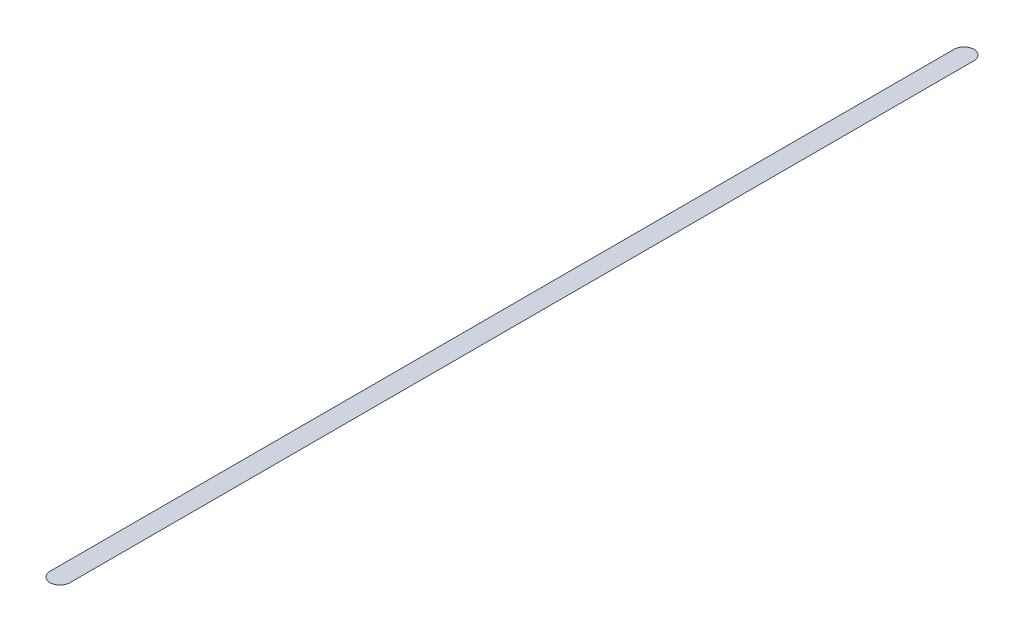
SolidWorks part; units mm, degrees
ref_plane "Plane1" through (0, 0, 0) normal (0, 0, 1) x (1, 0, 0)
ref_plane "Plane2" through (0, 0, 0) normal (0, 1, 0) x (1, 0, 0)
ref_plane "Plane3" through (0, 0, 0) normal (1, 0, 0) x (0, 0, -1)
sketch "Sketch1" plane through (0, 0, 0) normal (0, 0, 1) x (1, 0, 0)
  line L0 (-25, 5) -> (25, 5)
  line L1 (-25, 5) -> (-25, 0)
  line L2 (25, 0) -> (-25, 0)
  line L3 (25, 0) -> (25, 5)
  line L4 (0, 5) -> (0, 0) construction
  line L5 (50, 0) -> (-50, 0) construction
  dimension "D1" = 50
  dimension "D2" = 5
extrude "Base-Extrude" add sketch "Sketch1" along normal mid plane 203.2
sketch "Sketch10" plane through (0, 0, 0) normal (0, 1, 0) x (-1, 0, 0)
  line L4 (0.635, 88.265) -> (0.635, -88.265) construction
  line L5 (0, 50) -> (0, -50) construction
  line L6 (-0.635, 88.265) -> (-0.635, -88.265) construction
  line L8 (-0.635, 0) -> (0.635, 0) construction
  arc A0 (0.635, -88.265) -> (-0.635, -88.265) centre (0, -88.265) cw construction
  arc A1 (-0.635, 88.265) -> (0.635, 88.265) centre (0, 88.265) cw construction
  dimension "D1" = 1.27
  dimension "Rib Length" = 177.8
ref_plane "Plane4" through (0, 0, -88.265) normal (0, 0, 1) x (1, 0, 0)
ref_plane "Plane5" through (0, 0, 88.265) normal (0, 0, 1) x (1, 0, 0)
sketch "Sketch2" plane through (0, 0, -88.265) normal (0, 0, 1) x (1, 0, 0)
  line L0 (25, 0) -> (-25, 0) construction
  line L1 (0, -50) -> (0, 50) construction
  line L2 (0.635, 0) -> (-0.635, 0) construction
  line L3 (0.635, 0) -> (0.635, -0.582) construction
  line L4 (0.635, -0.582) -> (-0.635, -0.582) construction
  line L5 (-0.635, -0.582) -> (-0.635, 0) construction
  line L6 (-0.254, 0) -> (0.254, 0)
  arc A0 (-0.254, 0) -> (0.254, 0) centre (0, -0.582) ccw
  point P10 (0, 0)
  dimension "D1" = 1.217
  dimension "D2" = 0.508
extrude "Boss-Extrude1" add sketch "Sketch2" along normal up to surface (176.53 mm away)
sketch "Sketch7" plane through (0, 0, 88.265) normal (0, 0, 1) x (1, 0, 0)
  line L1 (0, 0) -> (0, -1.217)
  line L2 (0.254, 0) -> (-0.254, 0)
  line L3 (0, 0) -> (-0.254, 0)
  arc A1 (-0.254, 0) -> (0.254, 0) centre (0, -0.582) ccw
  arc A2 (-0.254, 0) -> (0, -1.217) centre (0, -0.582) ccw
  dimension "D1" = 0
revolve "Boss-Revolve3" add sketch "Sketch7" angle 180 about L1
sketch "Sketch9" plane through (0, 0, -88.265) normal (0, 0, 1) x (1, 0, 0)
  line L1 (0, 0) -> (0, -1.217)
  line L2 (0, 0) -> (0, -1.217) construction
  line L3 (0, 0) -> (-0.254, 0)
  line L4 (0, 0) -> (-0.254, 0) construction
  arc A2 (-0.254, 0) -> (0, -1.217) centre (0, -0.582) ccw
revolve "Boss-Revolve4" add sketch "Sketch9" angle 180 about L1
fillet "Fillet3" radius 1.524 4 edges at (0.254, 0, 0) (-0.254, 0, 0) (0, 0, 88.519) (0, 0, -88.519)
sketch "Sketch3" plane through (-25, 0, 0) normal (-1, 0, 0) x (0, 0, 1)
  line L4 (-101.6, 0) -> (101.6, 0)
  line L5 (101.6, 0) -> (101.6, 5)
  line L6 (101.6, 5) -> (-101.6, 5)
  line L7 (-101.6, 5) -> (-101.6, 0)
  line L8 (-101.6, 0) -> (101.6, 0)
  line L9 (101.6, 0) -> (101.6, 5)
  line L10 (101.6, 5) -> (-101.6, 5)
  line L11 (-101.6, 5) -> (-101.6, 0)
  dimension "D1" = 0
extrude "Cut-Extrude1" cut sketch "Sketch3" against normal through all
sketch "Orientation Sketch" plane through (0, 0, 0) normal (0, 1, 0) x (-1, 0, 0)
  line L0 (-20.634, 0) -> (20.634, 0) construction
  line L1 (50, 0) -> (-50, 0) construction
  line L2 (1.9427, -88.265) -> (1.9427, 88.265)
  line L3 (1.9427, -88.265) -> (1.9427, 88.265)
  line L4 (-1.9427, 88.265) -> (-1.9427, -88.265)
  line L5 (-1.9427, 88.265) -> (-1.9427, -88.265)
  arc A2 (-1.9427, -88.265) -> (1.9427, -88.265) centre (0, -88.265) ccw
  arc A3 (-1.9427, -88.265) -> (1.9427, -88.265) centre (0, -88.265) ccw
  arc A4 (1.9427, 88.265) -> (-1.9427, 88.265) centre (0, 88.265) ccw
  arc A5 (1.9427, 88.265) -> (-1.9427, 88.265) centre (0, 88.265) ccw
  point P10 (0, 0)
  dimension "D1" = 0
sketch "Orientation Sketch" plane through (0, 0, 0) normal (0, 1, 0) x (1, 0, 0)
  line L0 (-1.9427, 88.265) -> (-1.9427, -88.265) construction
  line L1 (1.9427, -88.265) -> (1.9427, 88.265) construction
  line L2 (-1.9427, 88.265) -> (-1.9427, -88.265)
  line L3 (1.9427, -88.265) -> (1.9427, 88.265)
  arc A0 (-1.9427, -88.265) -> (1.9427, -88.265) centre (0, -88.265) ccw construction
  arc A1 (1.9427, 88.265) -> (-1.9427, 88.265) centre (0, 88.265) ccw construction
  arc A2 (-1.9427, -88.265) -> (1.9427, -88.265) centre (0, -88.265) ccw
  arc A3 (1.9427, 88.265) -> (-1.9427, 88.265) centre (0, 88.265) ccw
other "FormTool1"
